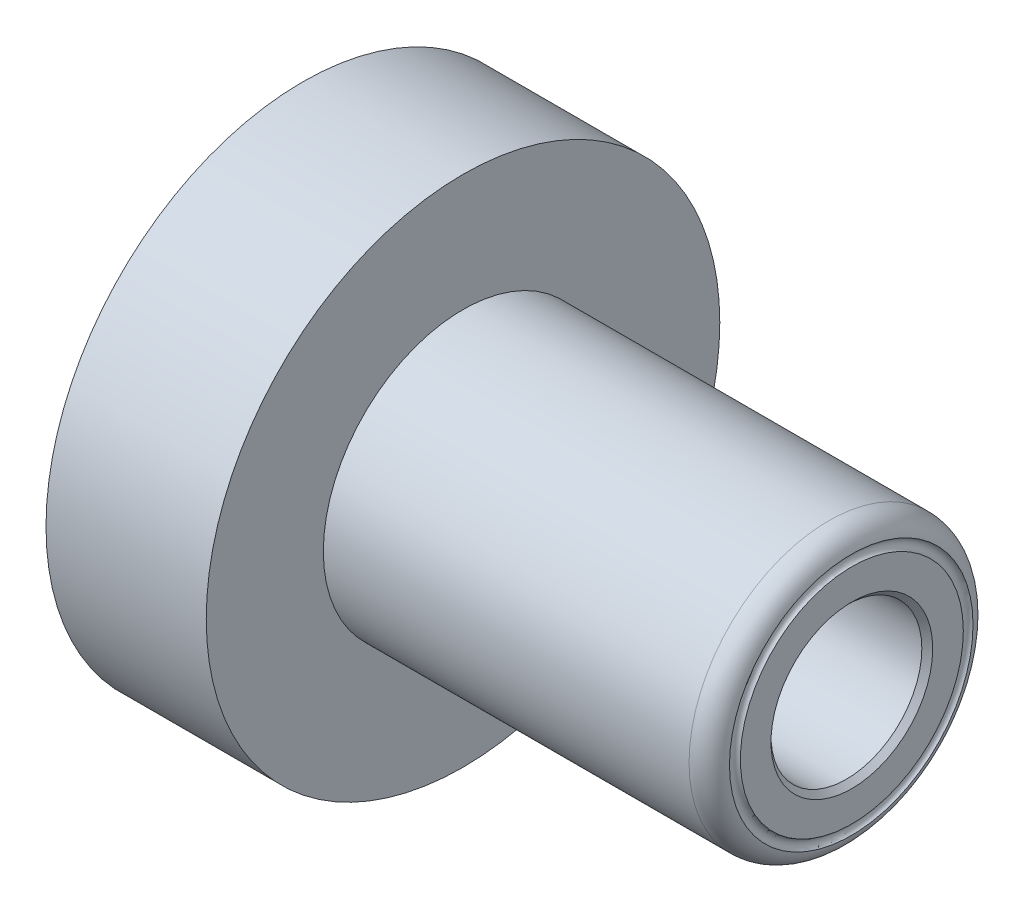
SolidWorks part; units mm, degrees
ref_plane "Front Plane" through (0, 0, 0) normal (0, 0, 1) x (1, 0, 0)
ref_plane "Top Plane" through (0, 0, 0) normal (0, 1, 0) x (1, 0, 0)
ref_plane "Right Plane" through (0, 0, 0) normal (1, 0, 0) x (0, 0, -1)
sketch "Sketch1" plane through (0, 0, 0) normal (0, 0, 1) x (1, 0, 0)
  line L0 (0, 0) -> (102.3864, 0) construction
  line L1 (0, 6.7437) -> (0, 17.4625)
  line L2 (0, 17.4625) -> (10.8966, 17.4625)
  line L3 (10.8966, 17.4625) -> (10.8966, 9.4996)
  line L4 (10.8966, 9.4996) -> (35.768, 9.4996)
  line L5 (37.338, 7.9296) -> (37.338, 0)
  line L6 (37.338, 0) -> (20.447, 0)
  line L7 (0, 6.7437) -> (20.447, 6.7437)
  line L8 (20.447, 6.7437) -> (20.447, 0)
  arc A0 (37.338, 7.9296) -> (35.768, 9.4996) centre (35.768, 7.9296) ccw
  dimension "D5" = 1.57
  dimension "D1" = 10.8966
  dimension "D2" = 34.925
  dimension "D3" = 20.447
  dimension "D4" = 13.4874
  dimension "D6" = 37.338
  dimension "D7" = 18.9992
revolve "Revolve1" add sketch "Sketch1" angle 360 about L0
sketch "Sketch2" plane through (0, 0, 0) normal (-1, 0, 0) x (0, 0, 1)
  line L0 (0, 0) -> (0, 9.7644) construction
  circle A0 centre (-11.1125, 0) radius 1.6129
  circle A1 centre (11.1125, 0) radius 1.6129
  dimension "D2" = 3.2258
  dimension "D1" = 22.225
extrude "Cut-Extrude1" cut sketch "Sketch2" against normal blind 6.35
sketch "Sketch3" plane through (37.338, 0, 0) normal (1, 0, 0) x (0, 0, -1)
  circle A0 centre (0, 0) radius 5.13
  dimension "D1" = 10.26
extrude "Cut-Extrude2" cut sketch "Sketch3" against normal through all
chamfer "Chamfer1" distance 0.37 angle 45 1 edges at (37.338, 0, -5.13)
sketch "Sketch4" plane through (0, 0, 0) normal (0, 0, 1) x (1, 0, 0)
  line L0 (0, 0) -> (40.0607, 0) construction
  line L1 (0, 17.4625) -> (0, -17.4625) construction
  circle A0 centre (37.467, 7.94) radius 0.381
  dimension "D1" = 7.94
  dimension "D2" = 37.467
  dimension "D3" = 0.381
revolve "Cut-Revolve1" cut sketch "Sketch4" angle 360 about L0
